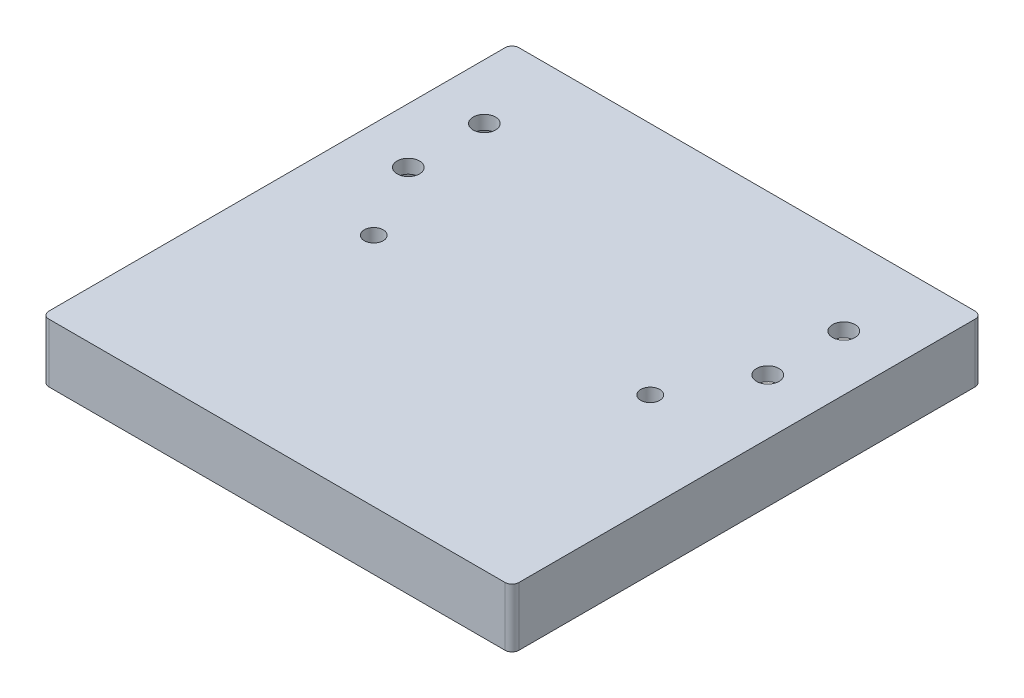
SolidWorks part; units mm, degrees
ref_plane "Front Plane" through (0, 0, 0) normal (0, 0, 1) x (1, 0, 0)
ref_plane "Top Plane" through (0, 0, 0) normal (0, 1, 0) x (1, 0, 0)
ref_plane "Right Plane" through (0, 0, 0) normal (1, 0, 0) x (0, 0, -1)
sketch "Sketch1" plane through (0, 0, 0) normal (0, 1, 0) x (1, 0, 0)
  line L0 (-49.4834, 45.4257) -> (-49.4834, -90.5743) construction
  line L1 (-115.4834, 45.4257) -> (16.5166, 45.4257)
  line L2 (-117.4834, 43.4257) -> (-117.4834, -88.5743)
  line L3 (-115.4834, -90.5743) -> (16.5166, -90.5743)
  line L4 (18.5166, 43.4257) -> (18.5166, -88.5743)
  line L5 (-117.4834, -22.5743) -> (18.5166, -22.5743) construction
  arc A0 (-117.4834, -88.5743) -> (-115.4834, -90.5743) centre (-115.4834, -88.5743) ccw
  arc A1 (16.5166, -90.5743) -> (18.5166, -88.5743) centre (16.5166, -88.5743) ccw
  arc A2 (16.5166, 45.4257) -> (18.5166, 43.4257) centre (16.5166, 43.4257) cw
  arc A3 (-115.4834, 45.4257) -> (-117.4834, 43.4257) centre (-115.4834, 43.4257) ccw
  circle A4 centre (-101.4834, 21.4257) radius 3.25
  circle A5 centre (-101.4834, -0.5743) radius 3.25
  circle A6 centre (2.5166, 21.4257) radius 3.25
  circle A7 centre (2.5166, -0.5743) radius 3.25
  circle A8 centre (-89.4834, -22.5743) radius 2.75
  circle A9 centre (-9.4834, -22.5743) radius 2.75
  point P10 (18.5166, 45.4257)
  point P13 (-117.4834, 45.4257)
  point P32 (-49.4834, -22.5743)
  dimension "D2" = 2
  dimension "D11" = 6.5
  dimension "D14" = 5.5
  dimension "D1" = 136
  dimension "D3" = 52
  dimension "D4" = 52
  dimension "D5" = 52
  dimension "D6" = 52
  dimension "D7" = 22
  dimension "D8" = 44
  dimension "D9" = 22
  dimension "D10" = 44
  dimension "D12" = 40
  dimension "D13" = 40
extrude "Boss-Extrude2" add sketch "Sketch1" along normal blind 17
sketch "Sketch2" plane through (0, 0, 0) normal (0, -1, 0) x (1, 0, 0)
  line L0 (-117.4834, -43.4257) -> (-117.4834, 88.5743) construction
  line L1 (-113.4834, 86.5743) -> (14.5166, 86.5743)
  line L2 (-113.4834, 86.5743) -> (-113.4834, -41.4257)
  line L3 (-113.4834, -41.4257) -> (14.5166, -41.4257)
  line L4 (14.5166, 86.5743) -> (14.5166, -41.4257)
  line L5 (18.5166, 88.5743) -> (18.5166, -43.4257) construction
  line L6 (16.5166, -45.4257) -> (-115.4834, -45.4257) construction
  line L7 (-115.4834, 90.5743) -> (16.5166, 90.5743) construction
  dimension "D1" = 4
  dimension "D2" = 4
  dimension "D3" = 4
  dimension "D4" = 4
extrude "Cut-Extrude1" cut sketch "Sketch2" against normal blind 13
sketch "Sketch3" plane through (0, 13, 0) normal (0, -1, 0) x (1, 0, 0)
  line L0 (14.5166, -41.4257) -> (14.5166, 86.5743) construction
  line L1 (14.5166, 86.5743) -> (-113.4834, 86.5743) construction
  circle A0 centre (-49.4834, 22.5743) radius 5
  dimension "D3" = 10
  dimension "D1" = 64
  dimension "D2" = 64
extrude "Boss-Extrude5" add sketch "Sketch3" along normal blind 13
sketch "Sketch4" plane through (0, 17, 0) normal (0, 1, 0) x (1, 0, 0)
  text T0 "Gjalt Nieuwenhuis  S1067869  ProPie"
hole_wizard "M5 Tapped Hole2" positions "Sketch7" profile "Sketch8" tap size "M5" standard "ISO"
sketch "Sketch7" plane through (0, 0, 0) normal (0, -1, 0) x (-1, 0, 0)
  point P0 (49.4834, -22.6681)
sketch "Sketch8" plane through (-49.4834, 0, 22.6681) normal (1, 0, 0) x (0, 0, -1)
  line L0 (0, 0) -> (0, 13.2618)
  line L1 (0, 13.2618) -> (2.1, 12)
  line L2 (2.1, 12) -> (2.1, 0.425)
  line L3 (2.1, 0.425) -> (2.525, 0)
  line L5 (2.525, 0) -> (0, 0)
  line L6 (-2.1, 0.425) -> (-2.525, 0) construction
  line L10 (0, 13.2618) -> (-2.1, 12) construction
  line L11 (0, -6.35) -> (0, 107.95) construction
  dimension "Tap Drill Dia." = 4.2
  dimension "Tap Drill Depth" = 12
  dimension "Near C'Sink Dia." = 5.05
  dimension "Near C'Sink Angle" = 90
  dimension "Drill Angle" = 118
